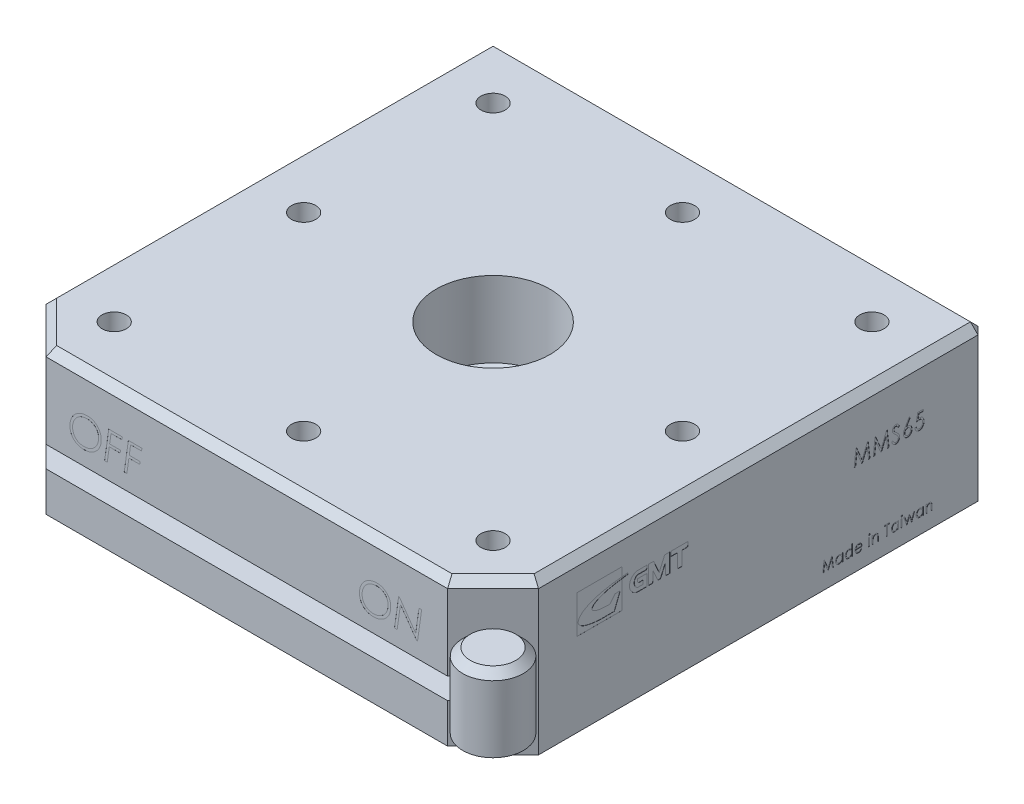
SolidWorks part; units mm, degrees
ref_plane "前基準面" through (0, 0, 0) normal (0, 0, 1) x (1, 0, 0)
ref_plane "上基準面" through (0, 0, 0) normal (0, 1, 0) x (1, 0, 0)
ref_plane "右基準面" through (0, 0, 0) normal (1, 0, 0) x (0, 0, -1)
sketch "草圖2" plane through (0, 0, 0) normal (0, 0, 1) x (1, 0, 0)
  line L0 (-32.5, 0) -> (-32.5, 20)
  line L1 (-32.5, 20) -> (32.5, 20)
  line L2 (32.5, 20) -> (32.5, 0)
  line L3 (32.5, 0) -> (28.5, 0)
  line L4 (28.5, 0) -> (28.5, 1)
  line L5 (28.5, 1) -> (-28.5, 1)
  line L6 (-28.5, 1) -> (-28.5, 0)
  line L7 (-28.5, 0) -> (-32.5, 0)
  line L8 (-28.547, 0) -> (29.6275, 0) construction
  line L9 (0, 41.8994) -> (0, -6.1761) construction
  dimension "D1" = 20
  dimension "D2" = 4
  dimension "D3" = 1
  dimension "D4" = 65
extrude "伸長2" add sketch "草圖2" along normal blind 65
chamfer "導角1" distance 6 angle 45 2 edges at (32.5, 10, 65) (-32.5, 10, 65)
chamfer "導角2" distance 1 angle 45 8 edges at (-32.5, 10, 0) (32.5, 10, 0) (0, 20, 0) (-32.5, 20, 29.5) (-29.5, 20, 62) (0, 20, 65) (29.5, 20, 62) (32.5, 20, 29.5)
ref_plane "平面1" through (0, 6.2, 0) normal (0, 1, 0) x (-1, 0, 0)
sketch "草圖5" plane through (-32.5, 0, 0) normal (-1, 0, 0) x (0, 0, 1)
  line L0 (65, 19) -> (65, 1) construction
  line L1 (65, 9) -> (59, 9)
  line L2 (65, 9) -> (65, 6.2)
  line L3 (65, 6.2) -> (59, 6.2)
  line L4 (59, 9) -> (59, 6.2)
  line L5 (59, 0) -> (1, 0) construction
  dimension "D1" = 6.2
  dimension "D2" = 2.8
  dimension "D3" = 6
extrude "除料-伸長1" cut sketch "草圖5" against normal blind 59.172
sketch "草圖3" plane through (0, 6.2, 0) normal (0, 1, 0) x (-1, 0, 0)
  line L0 (-24.7147, 51.5579) -> (-36.0284, 62.8716)
  line L2 (-30.3716, 68.5284) -> (-19.0579, 57.2147)
  line L3 (-19.0579, 57.2147) -> (-24.7147, 51.5579)
  line L4 (0, 32.5) -> (-31.8133, 64.3133) construction
  line L12 (-26.5, 65) -> (26.5, 65) construction
  line L13 (0, 65) -> (0, 0) construction
  arc A0 (-30.3716, 68.5284) -> (-36.0284, 62.8716) centre (-33.2, 65.7) ccw
  dimension "D2" = 8
  dimension "D4" = 20
  dimension "D5" = 45
  dimension "D1" = 4
  dimension "D3" = 4.7
extrude "伸長3" add sketch "草圖3" along normal blind 2.8
sketch "草圖4" plane through (0, 9, 0) normal (0, 1, 0) x (1, 0, 0)
  circle A0 centre (33.2, -65.7) radius 4
  dimension "D1" = 8
extrude "伸長4" add sketch "草圖4" along normal blind 7
hole_wizard "M16x2.0 螺紋孔1" positions "草圖7" profile "草圖6" tap size "M16x2.0" standard "JIS"
sketch "草圖7" plane through (0, 20, 0) normal (0, 1, 0) x (-1, 0, 0)
  line L0 (-26.5, 65) -> (26.5, 65) construction
  line L1 (-32.5, 1) -> (-32.5, 59) construction
  point P0 (0, 32.5)
  point P20 (-32.5, 30)
  dimension "D1" = 32.5
  dimension "D2" = 32.5
sketch "草圖6" plane through (0, 20, 32.5) normal (1, 0, 0) x (0, 0, 1)
  line L0 (0, 0) -> (0, 14.5065)
  line L1 (0, 14.5065) -> (7.5, 10)
  line L2 (7.5, 10) -> (7.5, 0)
  line L5 (7.5, 0) -> (0, 0)
  line L10 (0, 14.5065) -> (-7.5, 10) construction
  line L11 (0, -6.35) -> (0, 107.95) construction
  dimension "螺孔鑽直徑" = 15
  dimension "螺孔鑽深度" = 10
  dimension "導頭角度" = 118
hole_wizard "M4x0.7 螺紋孔1" positions "草圖10" profile "草圖11" tap size "M4x0.7" standard "JIS"
sketch "草圖10" plane through (0, 20, 0) normal (0, 1, 0) x (-1, 0, 0)
  line L2 (0, 49.4715) -> (0, -5.0377) construction
  line L6 (-26.5909, 32.5) -> (25.9814, 32.5) construction
  point P0 (-25, 57.5)
  point P1 (-25, 7.5)
  point P3 (25, 7.5)
  point P5 (25, 57.5)
  point P33 (0, 57.5)
  point P35 (-25, 32.5)
  point P37 (0, 7.5)
  point P39 (25, 32.5)
  dimension "D1" = 50
  dimension "D2" = 50
sketch "草圖11" plane through (25, 20, 57.5) normal (1, 0, 0) x (0, 0, 1)
  line L0 (0, 0) -> (0, 10.9614)
  line L1 (0, 10.9614) -> (1.6, 10)
  line L2 (1.6, 10) -> (1.6, 0)
  line L5 (1.6, 0) -> (0, 0)
  line L10 (0, 10.9614) -> (-1.6, 10) construction
  line L11 (0, -6.35) -> (0, 107.95) construction
  dimension "螺孔鑽直徑" = 3.2
  dimension "螺孔鑽深度" = 10
  dimension "導頭角度" = 118
chamfer "導角4" distance 1 angle 45 1 edges at (33.2, 16, 69.7)
sketch "草圖14" plane through (0, 0, 65) normal (0, 0, 1) x (1, 0, 0)
  line L0 (-23.54, 11) -> (25.6196, 11) construction
  line L1 (26.5, 9) -> (-26.5, 9) construction
  text T0 "<i>OFF                   ON</i>" font "Century Gothic" height in points 11
  dimension "D1" = 2
extrude "除料-伸長2" cut sketch "草圖14" against normal blind 0.005
sketch "草圖15" plane through (32.5, 0, 0) normal (1, 0, 0) x (0, 0, -1)
  line L0 (0, 19) -> (0, 0) construction
  line L1 (-58.5858, 20) -> (-1, 20) construction
  line L2 (-53.9, 16) -> (-48, 16)
  line L3 (-53.9, 16) -> (-53.9, 11)
  line L4 (-53.9, 11) -> (-48, 11)
  line L5 (-48, 16) -> (-48, 11)
  dimension "D1" = 5
  dimension "D2" = 5.9
  dimension "D3" = 48
  dimension "D4" = 4
extrude "除料-伸長3" cut sketch "草圖15" against normal blind 0.005
sketch "草圖16"
  dimension "D1" = 2
  dimension "D3" = 10
extrude "除料-伸長4" cut sketch "草圖16" along normal blind 0.03
